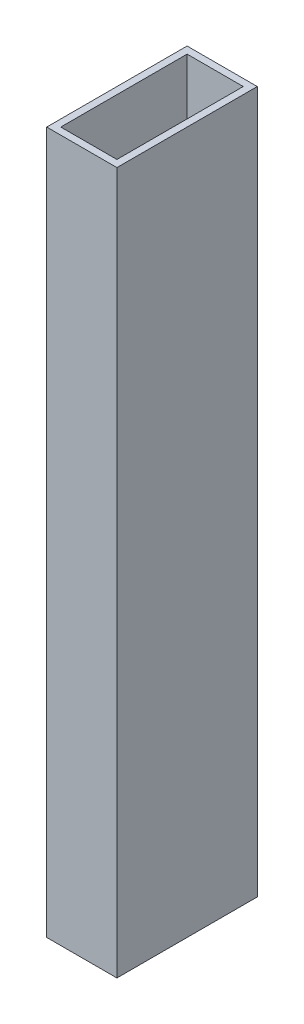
SolidWorks part; units mm, degrees
ref_plane "Спереди" through (0, 0, 0) normal (0, 0, 1) x (1, 0, 0)
ref_plane "Сверху" through (0, 0, 0) normal (0, 1, 0) x (1, 0, 0)
ref_plane "Справа" through (0, 0, 0) normal (1, 0, 0) x (0, 0, -1)
sketch "Sketch1" plane through (0, 0, 0) normal (0, 1, 0) x (1, 0, 0)
  line L1 (5, -10) -> (-5, -10)
  line L2 (5, -10) -> (5, 10)
  line L3 (5, 10) -> (-5, 10)
  line L4 (-5, -10) -> (-5, 10)
  line L5 (5, -10) -> (-5, 10) construction
  line L6 (5, 10) -> (-5, -10) construction
  line L7 (4, -9) -> (-4, -9)
  line L8 (4, -9) -> (4, 9)
  line L9 (4, 9) -> (-4, 9)
  line L10 (-4, -9) -> (-4, 9)
  line L11 (4, -9) -> (-4, 9) construction
  line L12 (4, 9) -> (-4, -9) construction
  point P0 (0, 0)
  point P6 (0, 0)
  dimension "D1" = 10
  dimension "D2" = 20
  dimension "D3" = 1
  dimension "D4" = 1
extrude "Boss-Extrude1" add sketch "Sketch1" along normal blind 100
